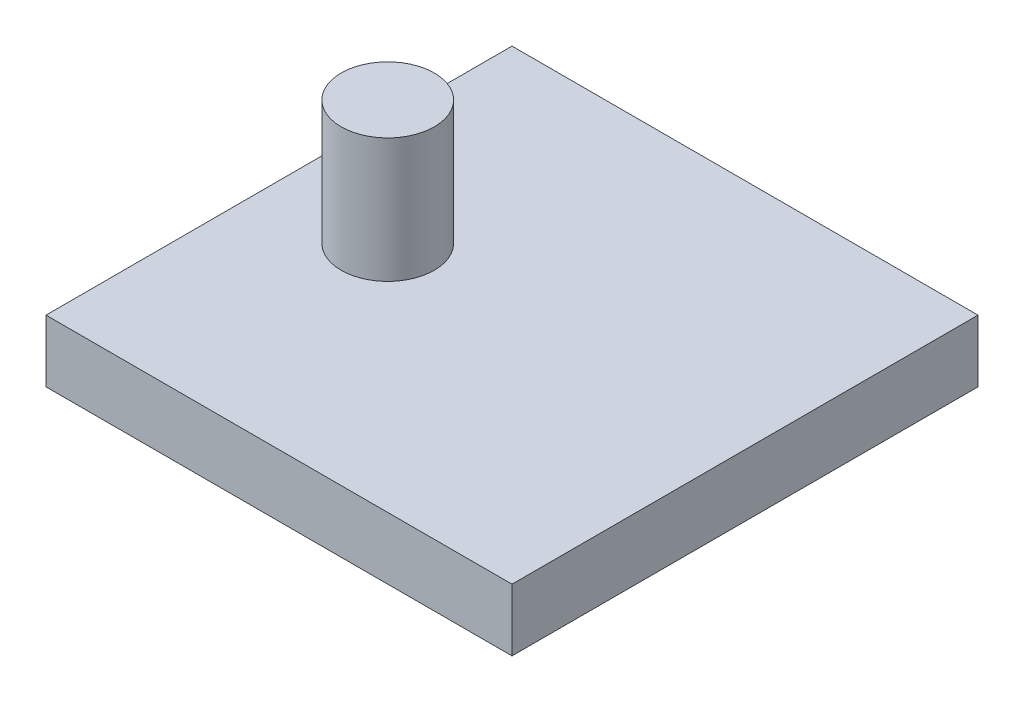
SolidWorks part; units mm, degrees
ref_plane "Front" through (0, 0, 0) normal (0, 0, 1) x (1, 0, 0)
ref_plane "Top" through (0, 0, 0) normal (0, 1, 0) x (1, 0, 0)
ref_plane "Right" through (0, 0, 0) normal (1, 0, 0) x (0, 0, -1)
sketch "Sketch1" plane through (0, 0, 0) normal (0, 1, 0) x (1, 0, 0)
  line L0 (75, -75) -> (-75, 75) construction
  line L1 (-75, 75) -> (75, 75)
  line L2 (-75, 75) -> (-75, -75)
  line L3 (-75, -75) -> (75, -75)
  line L4 (75, 75) -> (75, -75)
  dimension "D1" = 150
  dimension "D2" = 150
extrude "Extrude1" add sketch "Sketch1" along normal blind 20
sketch "Sketch2" plane through (0, 20, 0) normal (0, 1, 0) x (-1, 0, 0)
  circle A0 centre (40, 0) radius 15
  dimension "D2" = 30
  dimension "D1" = 40
extrude "Extrude2" add sketch "Sketch2" along normal blind 40
